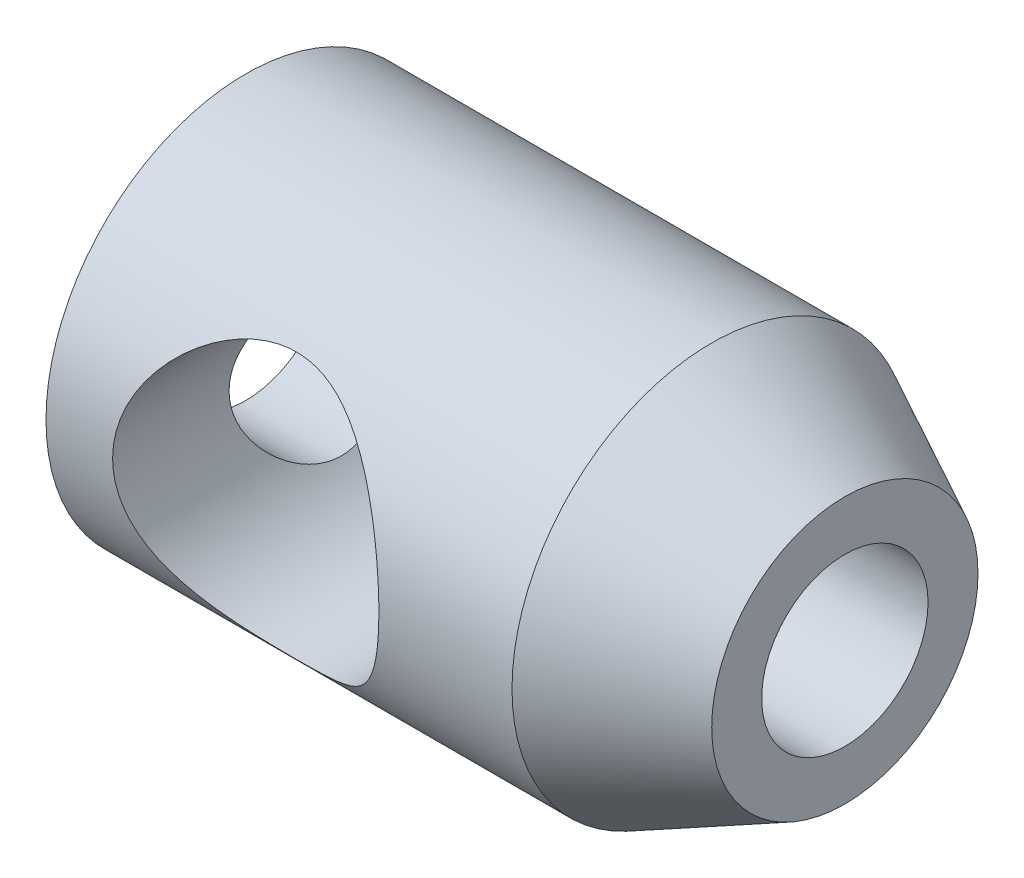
SolidWorks part; units mm, degrees
ref_plane "Face" through (0, 0, 0) normal (0, 0, 1) x (1, 0, 0)
ref_plane "Dessus" through (0, 0, 0) normal (0, 1, 0) x (1, 0, 0)
ref_plane "Droite" through (0, 0, 0) normal (1, 0, 0) x (0, 0, -1)
sketch "Esquisse1" plane through (0, 0, 0) normal (0, 0, 1) x (1, 0, 0)
  line L0 (0, 0) -> (0, 6)
  line L1 (0, 6) -> (14, 6)
  line L2 (14, 6) -> (18, 4)
  line L3 (18, 4) -> (18, 0)
  line L4 (-27.94, 0) -> (74.0691, 0) construction
  line L5 (0, 0) -> (18, 0)
  dimension "D1" = 18
  dimension "D2" = 4
  dimension "D3" = 12
  dimension "D4" = 8
revolve "Révolution1" add sketch "Esquisse1" angle 360 about L4
hole_wizard "Trou taraudé M6x1.01" positions "Esquisse3" profile "Esquisse2" tap size "M6x1.0" standard "ISO"
sketch "Esquisse3" plane through (18, 0, 0) normal (1, 0, 0) x (0, 0, -1)
  point P0 (0, 0)
sketch "Esquisse2" plane through (18, 0, 0) normal (0, 1, 0) x (0, 0, -1)
  line L0 (0, 0) -> (0, 18)
  line L1 (0, 18) -> (2.5, 18)
  line L2 (2.5, 18) -> (2.5, 0)
  line L5 (2.5, 0) -> (0, 0)
  line L11 (0, -6.35) -> (0, 107.95) construction
  dimension "Diamètre du trou pour taraudage jusqu'au prochain" = 5
  dimension "Profondeur du trou pour taraudage jusqu'au prochain" = 18
sketch "Esquisse4" plane through (0, 0, 0) normal (0, 0, 1) x (1, 0, 0)
  line L0 (0, 6) -> (0, -6) construction
  circle A0 centre (6, 0) radius 4
  dimension "D1" = 8
  dimension "D2" = 6
extrude "Enlèv. mat.-Extru.1" cut sketch "Esquisse4" against normal mid plane 30
